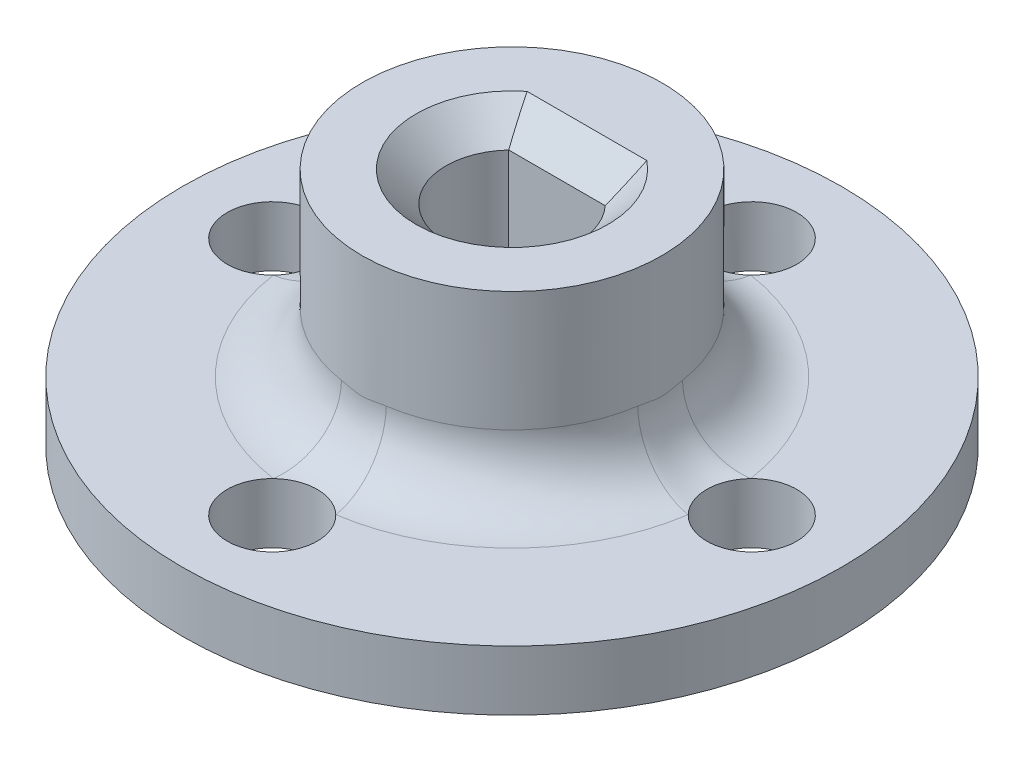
SolidWorks part; units mm, degrees
ref_plane "Front Plane" through (0, 0, 0) normal (0, 0, 1) x (1, 0, 0)
ref_plane "Top Plane" through (0, 0, 0) normal (0, 1, 0) x (1, 0, 0)
ref_plane "Right Plane" through (0, 0, 0) normal (1, 0, 0) x (0, 0, -1)
sketch "Sketch1" plane through (0, 0, 0) normal (0, 1, 0) x (1, 0, 0)
  line L0 (0, 11) -> (0, -11) construction
  line L1 (-11, 0) -> (11, 0) construction
  circle A0 centre (0, 0) radius 11
  circle A1 centre (0, 8) radius 1.5
  circle A2 centre (-8, 0) radius 1.5
  circle A3 centre (8, 0) radius 1.5
  circle A4 centre (0, -8) radius 1.5
  dimension "D1" = 22
  dimension "D2" = 3
  dimension "D3" = 8
  dimension "D4" = 8
  dimension "D5" = 8
  dimension "D6" = 8
extrude "Boss-Extrude1" add sketch "Sketch1" along normal blind 2
sketch "Sketch2" plane through (0, 2, 0) normal (0, 1, 0) x (1, 0, 0)
  circle A0 centre (0, 0) radius 5
  dimension "D1" = 10
extrude "Boss-Extrude2" add sketch "Sketch2" along normal blind 6
sketch "Sketch3" plane through (0, 8, 0) normal (0, 1, 0) x (1, 0, 0)
  line L0 (-1.6093, 1.5) -> (1.6093, 1.5)
  arc A0 (-1.6093, 1.5) -> (1.6093, 1.5) centre (0, 0) ccw
  dimension "D1" = 4.4
  dimension "D2" = 1.5
extrude "Cut-Extrude1" cut sketch "Sketch3" against normal through all
chamfer "Chaflán4" distance 1 angle 45 2 edges at (0, 8, -1.5) (0, 8, 2.2)
fillet "Redondeo1" radius 2 1 edges at (0, 2, 5)
